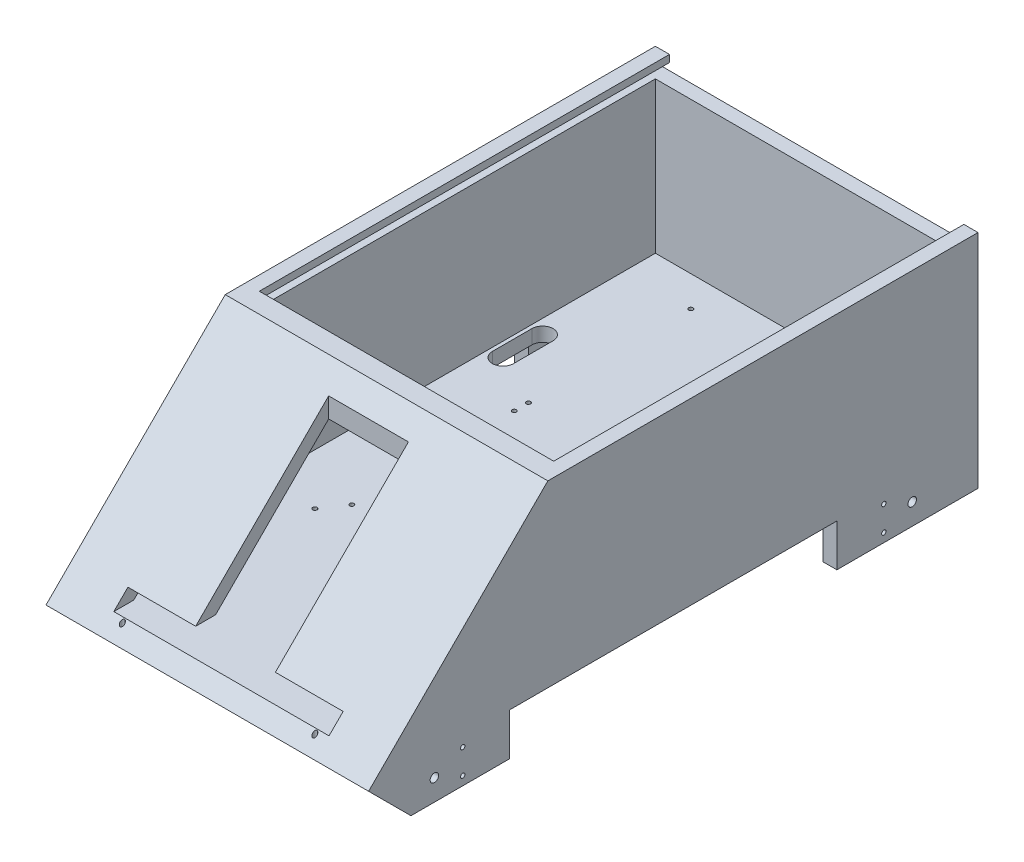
SolidWorks part; units mm, degrees
ref_plane "Front Plane" through (0, 0, 0) normal (0, 0, 1) x (1, 0, 0)
ref_plane "Top Plane" through (0, 0, 0) normal (0, 1, 0) x (1, 0, 0)
ref_plane "Right Plane" through (0, 0, 0) normal (1, 0, 0) x (0, 0, -1)
ref_plane "Metal_Det_Plane" through (0, 0, -5) normal (0, 0, -1) x (-1, 0, 0)
ref_plane "Center_Plane" through (0, 0, -215.9) normal (0, 0, -1) x (-1, 0, 0)
sketch "Centerline" plane through (0, 0, 0) normal (1, 0, 0) x (0, 0, -1)
  line L0 (-1000, 0) -> (49000, 0) construction
sketch "Sketch3" plane through (0, 0, 0) normal (1, 0, 0) x (0, 0, -1)
  line L3 (0, 0) -> (431.8, 0)
  line L4 (431.8, 0) -> (431.8, 127)
  line L5 (431.8, 127) -> (127, 127)
  line L6 (0, 0) -> (127, 127)
  point P3 (127, 0)
  point P4 (0, 0)
  dimension "D1" = 127
  dimension "D2" = 431.8
  dimension "D3" = 45
  dimension "D4" = 304.8
  dimension "D5" = 304.8
extrude "Boss-Extrude2" add sketch "Sketch3" along normal mid plane 228.6 contours L6 L5 L4 L3
shell "Shell2" thickness 10
sketch "Sketch4" plane through (0, 0, -431.8) normal (0, 0, -1) x (-1, 0, 0)
  line L0 (-104.3, 127) -> (-104.3, 122)
  line L1 (-114.3, 127) -> (114.3, 127) construction
  line L2 (-114.3, 127) -> (-114.3, 0) construction
  line L3 (-114.3, 0) -> (114.3, 0) construction
  line L4 (114.3, 127) -> (114.3, 0) construction
  line L5 (-114.3, 127) -> (114.3, 127) construction
  line L6 (-114.3, 127) -> (-114.3, 0) construction
  line L11 (-114.3, 0) -> (114.3, 0) construction
  line L13 (114.3, 127) -> (114.3, 0) construction
  line L14 (-114.3, 127) -> (114.3, 0) construction
  line L15 (-114.3, 0) -> (114.3, 127) construction
  line L16 (-104.3, 122) -> (-109.3, 122)
  line L17 (-109.3, 122) -> (-109.3, 117)
  line L18 (-109.3, 117) -> (-104.3, 117)
  line L19 (-104.3, 117) -> (-104.3, 10)
  line L20 (0, 0) -> (0, 127) construction
  line L21 (104.3, 10) -> (-104.3, 10)
  line L22 (104.3, 127) -> (104.3, 122)
  line L23 (104.3, 122) -> (109.3, 122)
  line L24 (109.3, 122) -> (109.3, 117)
  line L25 (109.3, 117) -> (104.3, 117)
  line L26 (104.3, 117) -> (104.3, 10)
  line L27 (-104.3, 117) -> (104.3, 117)
  line L28 (-104.3, 122) -> (104.3, 122)
  line L29 (-104.3, 127) -> (104.3, 127)
  point P8 (0, 63.5)
  point P20 (0, 63.5)
  point P24 (0, 10)
  dimension "D1" = 5
  dimension "D2" = 10
  dimension "D3" = 10
  dimension "D4" = 5
  dimension "D5" = 5
  dimension "D6" = 10
  dimension "D7" = 218.6
extrude "Cut-Extrude2" cut sketch "Sketch4" against normal blind 299.8 contours L27 L18 L17 L16 L28 L23 L24 L25
sketch "Sketch5" plane through (0, 0, -431.8) normal (0, 0, -1) x (-1, 0, 0)
  line L0 (-104.3, 122) -> (-104.3, 127)
  line L1 (-104.3, 127) -> (104.3, 127)
  line L2 (104.3, 127) -> (104.3, 122)
  line L3 (104.3, 122) -> (-104.3, 122)
extrude "Cut-Extrude3" cut sketch "Sketch5" against normal blind 10
ref_plane "Hardware_Surface Plane" through (0, 10, 0) normal (0, 1, 0) x (1, 0, 0)
sketch "Reference1 Base " plane through (0, 0, 0) normal (0, -1, 0) x (1, 0, 0)
  line L0 (76.2, 0) -> (-76.2, 0) construction
  line L1 (114.3, 0) -> (-114.3, 0) construction
  line L2 (-76.2, 0) -> (-76.2, -152.4) construction
  line L3 (-76.2, -152.4) -> (76.2, -152.4) construction
  line L4 (76.2, -152.4) -> (76.2, 0) construction
  line L5 (0, -69.85) -> (0, 69.85) construction
  circle A0 centre (-68.2, -144.4) radius 1.55
  circle A1 centre (-68.2, -8) radius 1.55
  circle A2 centre (68.2, -144.4) radius 1.55
  circle A3 centre (68.2, -8) radius 1.55
  point P6 (0, 0)
  point P12 (-63.0601, -10.1995)
  point P19 (-64.2829, -6.1598)
  point P20 (0, 0)
  dimension "D3" = 8
  dimension "D5" = 3.1
  dimension "D8" = 3.1
  dimension "D1" = 152.4
  dimension "D2" = 152.4
  dimension "D4" = 8
  dimension "D6" = 8
  dimension "D7" = 8
sketch "Reference2 Base" plane through (-114.3, 0, 0) normal (-1, 0, 0) x (0, 0, 1)
  line L0 (-10, 10) -> (-10, 0) construction
  line L1 (0, 0) -> (-127, 127) construction
  line L2 (-152.4, 0) -> (0, 0) construction
  dimension "D1" = 10
sketch "Reference3 Base" plane through (0, 0, 0) normal (0, 0.7071, 0.7071) x (1, 0, 0)
  line L0 (-114.3, 14.1421) -> (114.3, 14.1421) construction
  line L1 (114.3, 0) -> (114.3, 179.6051) construction
sketch "Base hole" plane through (0, 10, 0) normal (0, 1, 0) x (1, 0, 0)
  line L0 (-76.25, 10) -> (76.25, 10)
  line L1 (-76.25, 10) -> (-76.25, 162)
  line L2 (-76.25, 162) -> (76.25, 162)
  line L3 (76.25, 162) -> (76.25, 10)
  line L10 (-114.3, 10) -> (114.3, 10) construction
  line L12 (76.25, 162) -> (-76.25, 162) construction
  line L13 (76.25, 162) -> (76.25, 10) construction
  line L14 (76.25, 10) -> (-76.25, 10) construction
  line L15 (-76.25, 162) -> (-76.25, 10) construction
  line L16 (76.25, 162) -> (-76.25, 10) construction
  line L17 (76.25, 10) -> (-76.25, 162) construction
  point P3 (0, 10)
  point P6 (0, 86)
  dimension "D1" = 152.5
  dimension "D2" = 152
  dimension "D3" = 152
  dimension "D4" = 152.5
extrude "Cut-Extrude5" cut sketch "Base hole" along normal blind 10
sketch "Sketch16" plane through (0, 10, 0) normal (0, 1, 0) x (1, 0, 0)
  line L1 (-28.25, 114.25) -> (28.25, 114.25)
  line L2 (-28.25, 114.25) -> (-28.25, 57.75)
  line L3 (-28.25, 57.75) -> (28.25, 57.75)
  line L4 (28.25, 114.25) -> (28.25, 57.75)
  line L5 (-28.25, 114.25) -> (28.25, 57.75) construction
  line L6 (-28.25, 57.75) -> (28.25, 114.25) construction
  point P0 (0, 86)
  dimension "D1" = 56.5
  dimension "D2" = 56.5
extrude "Cut-Extrude7" cut sketch "Sketch16" along normal blind 120
sketch "Sketch17" plane through (0, 10, 0) normal (0, 1, 0) x (1, 0, 0)
  line L0 (-28.25, 57.75) -> (28.25, 57.75) construction
  line L1 (-28.25, 57.75) -> (28.25, 57.75)
  line L2 (-28.25, 57.75) -> (-28.25, 10)
  line L3 (-28.25, 10) -> (28.25, 10)
  line L4 (28.25, 57.75) -> (28.25, 10)
  line L6 (-28.25, 114.25) -> (-28.25, 57.75) construction
  line L7 (-114.3, 10) -> (114.3, 10) construction
  dimension "D1" = 56.5
extrude "Cut-Extrude8" cut sketch "Sketch17" along normal blind 120
ref_plane "Wall2 Plane" through (114.3, 0, 0) normal (1, 0, 0) x (0, 0, -1)
sketch "Sidewall_Motor_Tabs1" plane through (114.3, 0, 0) normal (1, 0, 0) x (0, 0, -1)
  line L0 (0, 0) -> (30, -30)
  line L1 (0, 0) -> (100, 0)
  line L3 (30, -30) -> (100, -30)
  line L4 (100, 0) -> (100, -30)
  line L5 (0, 0) -> (100, -30) construction
  line L6 (30, -30) -> (100, 0) construction
  line L8 (431.8, 0) -> (331.8, 0)
  line L9 (431.8, 0) -> (431.8, -30)
  line L10 (431.8, -30) -> (331.8, -30)
  line L11 (331.8, 0) -> (331.8, -30)
  line L12 (431.8, 0) -> (331.8, -30) construction
  line L13 (431.8, -30) -> (331.8, 0) construction
  point P4 (58.8235, -17.6471)
  point P13 (381.8, -15)
  dimension "D1" = 70
  dimension "D2" = 30
  dimension "D3" = 45
  dimension "D4" = 30
  dimension "D5" = 100
extrude "Motor_Mount_Wall1" add sketch "Sidewall_Motor_Tabs1" against normal blind 10
ref_plane "Wall1 Plane" through (-114.3, 0, 0) normal (-1, 0, 0) x (0, 0, 1)
sketch "Sidewall_Motor_Tabs2" plane through (-114.3, 0, 0) normal (-1, 0, 0) x (0, 0, 1)
  line L0 (0, 0) -> (-30, -30)
  line L1 (0, 0) -> (-100, 0)
  line L3 (-30, -30) -> (-100, -30)
  line L4 (-100, 0) -> (-100, -30)
  line L5 (0, 0) -> (-100, -30) construction
  line L6 (-30, -30) -> (-100, 0) construction
  line L8 (-431.8, 0) -> (-331.8, 0)
  line L9 (-431.8, 0) -> (-431.8, -30)
  line L10 (-431.8, -30) -> (-331.8, -30)
  line L11 (-331.8, 0) -> (-331.8, -30)
  line L12 (-431.8, 0) -> (-331.8, -30) construction
  line L13 (-431.8, -30) -> (-331.8, 0) construction
  point P4 (-58.8235, -17.6471)
  point P11 (-381.8, -15)
  dimension "D1" = 70
  dimension "D2" = 30
  dimension "D3" = 45
  dimension "D4" = 30
  dimension "D5" = 100
extrude "Motor_Mount_Wall2" add sketch "Sidewall_Motor_Tabs2" against normal blind 10
sketch "Side Wall Thickness Ref" plane through (-114.3, 0, 0) normal (-1, 0, 0) x (0, 0, 1)
  line L1 (-331.8, 0) -> (-100, 0) construction
  line L2 (-331.8, 0) -> (-331.8, 10) construction
  line L3 (-331.8, 10) -> (-100, 10) construction
  line L4 (-100, 0) -> (-100, 10) construction
  dimension "D1" = 10
sketch "Side Wall Thickness Ref1" plane through (0, 10, 0) normal (0, 1, 0) x (1, 0, 0)
  line L1 (-114.3, 331.8) -> (-104.3, 331.8) construction
  line L2 (-114.3, 331.8) -> (-114.3, 100) construction
  line L3 (-114.3, 100) -> (-104.3, 100) construction
  line L4 (-104.3, 331.8) -> (-104.3, 100) construction
  dimension "D1" = 10
sketch "Rear Slots" plane through (0, 10, 0) normal (0, 1, 0) x (1, 0, 0)
  line L0 (-94.3, 331.8) -> (-94.3, 303.8) construction
  line L1 (-86.8, 331.8) -> (-86.8, 303.8)
  line L2 (-101.8, 331.8) -> (-101.8, 303.8)
  line L3 (0, -69.85) -> (0, 69.85) construction
  line L4 (94.3, 331.8) -> (94.3, 303.8) construction
  line L5 (86.8, 331.8) -> (86.8, 303.8)
  line L6 (101.8, 331.8) -> (101.8, 303.8)
  arc A0 (-86.8, 331.8) -> (-101.8, 331.8) centre (-94.3, 331.8) ccw
  arc A1 (-101.8, 303.8) -> (-86.8, 303.8) centre (-94.3, 303.8) ccw
  arc A2 (86.8, 331.8) -> (101.8, 331.8) centre (94.3, 331.8) cw
  arc A3 (101.8, 303.8) -> (86.8, 303.8) centre (94.3, 303.8) cw
  point P2 (-94.3, 317.8)
  point P14 (94.3, 317.8)
  dimension "D2" = 28
  dimension "D1" = 15
  dimension "D3" = 10
extrude "Cut-Extrude_Rear Slots" cut sketch "Rear Slots" against normal blind 10
sketch "Front Slots" plane through (0, 10, 0) normal (0, 1, 0) x (1, 0, 0)
  line L0 (-94.3, 128) -> (-94.3, 100) construction
  line L1 (-86.8, 128) -> (-86.8, 100)
  line L2 (-101.8, 128) -> (-101.8, 100)
  line L3 (0, -69.85) -> (0, 69.85) construction
  line L4 (94.3, 128) -> (94.3, 100) construction
  line L5 (86.8, 128) -> (86.8, 100)
  line L6 (101.8, 128) -> (101.8, 100)
  arc A0 (-86.8, 128) -> (-101.8, 128) centre (-94.3, 128) ccw
  arc A1 (-101.8, 100) -> (-86.8, 100) centre (-94.3, 100) ccw
  arc A2 (86.8, 128) -> (101.8, 128) centre (94.3, 128) cw
  arc A3 (101.8, 100) -> (86.8, 100) centre (94.3, 100) cw
  point P2 (-94.3, 114)
  point P12 (94.3, 114)
  dimension "D1" = 15
  dimension "D2" = 28
  dimension "D3" = 10
extrude "Cut-Extrude_Front Slots" cut sketch "Front Slots" against normal blind 10
sketch "Sketch25" plane through (-114.3, 0, 0) normal (-1, 0, 0) x (0, 0, 1)
  line L0 (-331.8, -26.15) -> (-331.8, -3.85) construction
  line L1 (-331.8, 0) -> (-331.8, -30) construction
  line L2 (-331.8, -3.85) -> (-396.2, -3.85) construction
  line L3 (-396.2, -3.85) -> (-396.2, -26.15) construction
  line L4 (-396.2, -26.15) -> (-332.748, -26.15) construction
  line L5 (-331.8, -15) -> (-385.2, -15) construction
  line L6 (-365.1, -6.25) -> (-365.1, -23.75) construction
  line L7 (-215.9, 86.35) -> (-215.9, -86.35) construction
  line L8 (-66.7, -6.25) -> (-66.7, -23.75) construction
  line L9 (-100, -15) -> (-46.6, -15) construction
  line L10 (-35.6, -26.15) -> (-99.052, -26.15) construction
  line L11 (-35.6, -3.85) -> (-35.6, -26.15) construction
  line L12 (-100, -3.85) -> (-35.6, -3.85) construction
  line L13 (-100, -26.15) -> (-100, -3.85) construction
  circle A0 centre (-385.2, -15) radius 3
  circle A1 centre (-365.1, -6.25) radius 1.55
  circle A2 centre (-365.1, -23.75) radius 1.55
  circle A3 centre (-66.7, -23.75) radius 1.55
  circle A4 centre (-66.7, -6.25) radius 1.55
  circle A5 centre (-46.6, -15) radius 3
  point P5 (-331.8, -15)
  point P15 (-365.1, -15)
  point P31 (-66.7, -15)
  point P32 (-100, -15)
  dimension "D4" = 6
  dimension "D7" = 3.1
  dimension "D8" = 3.1
  dimension "D1" = 22.3
  dimension "D2" = 64.4
  dimension "D3" = 53.4
  dimension "D5" = 20.1
  dimension "D6" = 17.5
extrude "Motor_Holes" cut sketch "Sketch25" against normal through all
extrude "Cut-Extrude9" cut sketch "Reference1 Base " against normal blind 10
sketch "Sketch26" plane through (0, 0, 0) normal (0, -1, 0) x (1, 0, 0)
  line L0 (-76.2, -152.4) -> (76.2, -152.4) construction
  line L1 (-60.08, -157.4) -> (60.08, -157.4) construction
  line L2 (-60.08, -157.4) -> (-60.08, -277.56) construction
  line L3 (-60.08, -277.56) -> (60.08, -277.56) construction
  line L4 (60.08, -157.4) -> (60.08, -277.56) construction
  line L5 (-60.08, -157.4) -> (60.08, -277.56) construction
  line L6 (-60.08, -277.56) -> (60.08, -157.4) construction
  line L7 (-60.08, -282.56) -> (60.08, -282.56) construction
  line L8 (-60.08, -282.56) -> (-60.08, -402.72) construction
  line L11 (-60.08, -402.72) -> (60.08, -402.72) construction
  line L13 (0, -86.35) -> (0, 86.35) construction
  line L14 (60.08, -282.56) -> (60.08, -402.72) construction
  line L15 (-60.08, -282.56) -> (60.08, -402.72) construction
  line L16 (-60.08, -402.72) -> (60.08, -282.56) construction
  circle A0 centre (-57.54, -159.94) radius 1.5
  circle A1 centre (57.54, -159.94) radius 1.5
  circle A2 centre (-57.54, -275.02) radius 1.5
  circle A3 centre (57.54, -275.02) radius 1.5
  circle A4 centre (-57.54, -285.1) radius 1.5
  circle A6 centre (-57.54, -400.18) radius 1.5
  circle A8 centre (57.54, -285.1) radius 1.5
  circle A9 centre (57.54, -400.18) radius 1.5
  point P4 (0, -217.48)
  point P10 (0, 0)
  point P23 (0, -342.64)
  point P32 (0, 0)
  dimension "D7" = 3
  dimension "D10" = 2.54
  dimension "D12" = 3
  dimension "D13" = 3
  dimension "D4" = 120.16
  dimension "D17" = 3
  dimension "D1" = 120.16
  dimension "D2" = 120.16
  dimension "D3" = 5
  dimension "D5" = 120.16
  dimension "D6" = 2.54
  dimension "D8" = 2.54
  dimension "D9" = 2.54
  dimension "D11" = 2.54
  dimension "D14" = 2.54
  dimension "D15" = 2.54
  dimension "D16" = 2.54
  dimension "D18" = 5
extrude "Cut-Extrude_TowerBase_Holes" cut sketch "Sketch26" against normal blind 10
